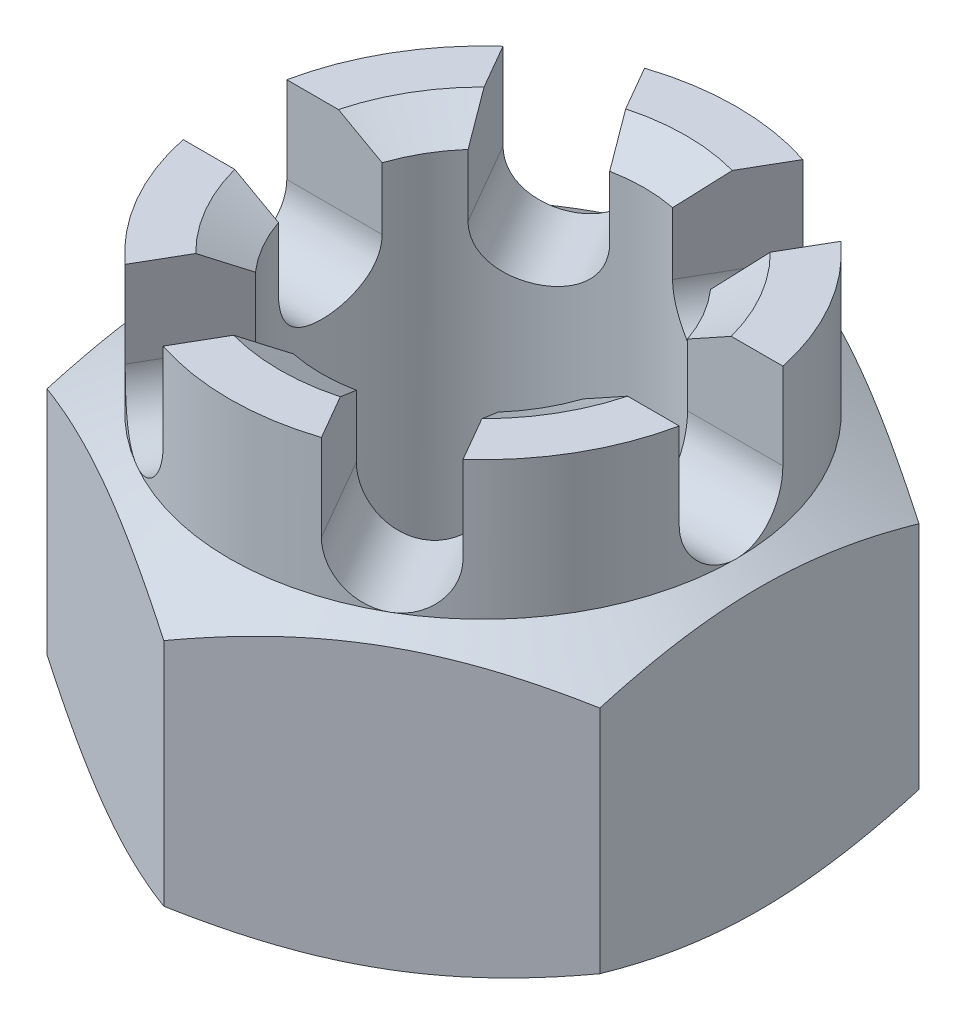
SolidWorks part; units mm, degrees
ref_plane "Front Plane" through (0, 0, 0) normal (0, 0, 1) x (1, 0, 0)
ref_plane "Top Plane" through (0, 0, 0) normal (0, 1, 0) x (1, 0, 0)
ref_plane "Right Plane" through (0, 0, 0) normal (1, 0, 0) x (0, 0, -1)
sketch "BaseNutSke" plane through (0, 0, 0) normal (0, 1, 0) x (1, 0, 0)
  line L1 (0, 13.8564) -> (-12, 6.9282)
  line L2 (-12, 6.9282) -> (-12, -6.9282)
  line L3 (-12, -6.9282) -> (0, -13.8564)
  line L4 (0, -13.8564) -> (12, -6.9282)
  line L5 (12, -6.9282) -> (12, 6.9282)
  line L6 (12, 6.9282) -> (0, 13.8564)
  circle A0 centre (0, 0) radius 12 construction
  dimension "Width" = 24
extrude "BaseNut" add sketch "BaseNutSke" along normal blind 19
ref_plane "MidPlane" through (0, 9.5, 0) normal (0, 1, 0) x (-1, 0, 0)
sketch "CutNutSke" plane through (0, 0, 0) normal (1, 0, 0) x (0, 0, -1)
  line L0 (-13.8564, 19) -> (-11.5, 19)
  line L1 (-11.5, 19) -> (-13.8564, 17.6395)
  line L2 (-13.8564, 17.6395) -> (-13.8564, 19)
  line L3 (0, 0) -> (0, 8.4136) construction
  dimension "Chamf_ang" = 30
  dimension "Chamfer_diameter" = 23
revolve "CutNut" cut sketch "CutNutSke" angle 360 about L3
mirror "MirrorChamfer" about plane through (0, 9.5, 0) normal (0, 1, 0) of "CutNut"
sketch "HoleSke" plane through (0, 19, 0) normal (0, 1, 0) x (1, 0, 0)
  circle A0 centre (0, 0) radius 7
  dimension "Tap_drill" = 14
extrude "TappedHole" cut sketch "HoleSke" against normal through all
chamfer "Chamfer1" distance 1.05 angle 60 2 edges at (0, 19, 7) (0, 0, 7)
sketch "SlotSke" plane through (0, 0, 0) normal (1, 0, 0) x (0, 0, -1)
  line L0 (0, 0) -> (0, 7.747) construction
  line L2 (-2.25, 32) -> (2.25, 32)
  line L3 (-2.25, 32) -> (-2.25, 15.25)
  line L4 (-2.25, 13) -> (2.25, 13) construction
  line L5 (2.25, 32) -> (2.25, 15.25)
  arc A0 (-2.25, 15.25) -> (2.25, 15.25) centre (0, 15.25) ccw
  dimension "D1" = 19
  dimension "Slot_height" = 13
  dimension "Slot_width" = 4.5
extrude "Slot" cut sketch "SlotSke" against normal blind 28.8
pattern_circular "SlotPat" count 6 over 360 about axis through (0, 0, 0) along (0, 1, 0) of "Slot"
sketch "TopCutSke" plane through (0, 0, 0) normal (1, 0, 0) x (0, 0, -1)
  line L0 (-11, 32) -> (-11, 13)
  line L1 (-11, 13) -> (-33.5167, 0)
  line L2 (-33.5167, 0) -> (-33.5167, 32)
  line L3 (-33.5167, 32) -> (-11, 32)
  line L4 (0, 0) -> (0, 31.1327) construction
  line L5 (-11.5, 0) -> (11.5, 0) construction
  dimension "D1" = 60
  dimension "Top_diameter" = 22
  dimension "D2" = 13
  dimension "D3" = 19
revolve "TopCut" cut sketch "TopCutSke" angle 360 about L4
sketch "ThdSchSke" plane through (0, 0, 0) normal (0, 0, 1) x (1, 0, 0)
  line L0 (-8, 1.6274) -> (-7, 1.05)
  line L1 (-7, 1.05) -> (-5.8453, 1.05)
  line L2 (-5.8453, 1.05) -> (-5.8453, 2.2047)
  line L3 (-5.8453, 2.2047) -> (-7, 2.2047)
  line L4 (-7, 2.2047) -> (-8, 1.6274)
  line L5 (0, -3.4988) -> (0, 3.4988) construction
  line L8 (7, 1.05) -> (-7, 1.05) construction
  line L9 (7, 1.05) -> (-7, 1.05) construction
  dimension "ThreadN" = 16
  dimension "Tap_drill" = 14
revolve "ThreadSchematic" [suppressed] cut sketch "ThdSchSke" angle 360 about L5
pattern_linear "ThdSchPat" [suppressed]
equation "\"D1@Chamfer1\" = \"Tap_drill@HoleSke\"*0.075"
equation "\"D1@SlotSke\" = \"Height@BaseNut\""
equation "\"D1@Slot\" = \"Width@BaseNutSke\"*1.2"
equation "\"D2@TopCutSke\" = \"Slot_height@SlotSke\""
equation "\"D3@TopCutSke\" = \"Height@BaseNut\""
equation "\"Tap_drill@ThdSchSke\" = \"Tap_drill@HoleSke\""
equation "\"ThreadN@ThdSchSke\" = \"Thread_major@ThreadCosmetic\""
equation "\"Num_threads@ThdSchPat\" =  int(( \"Height@BaseNut\" - \"D1@Chamfer1\" *2) /\"Advance@ThdSchPat\" )  + 1"
